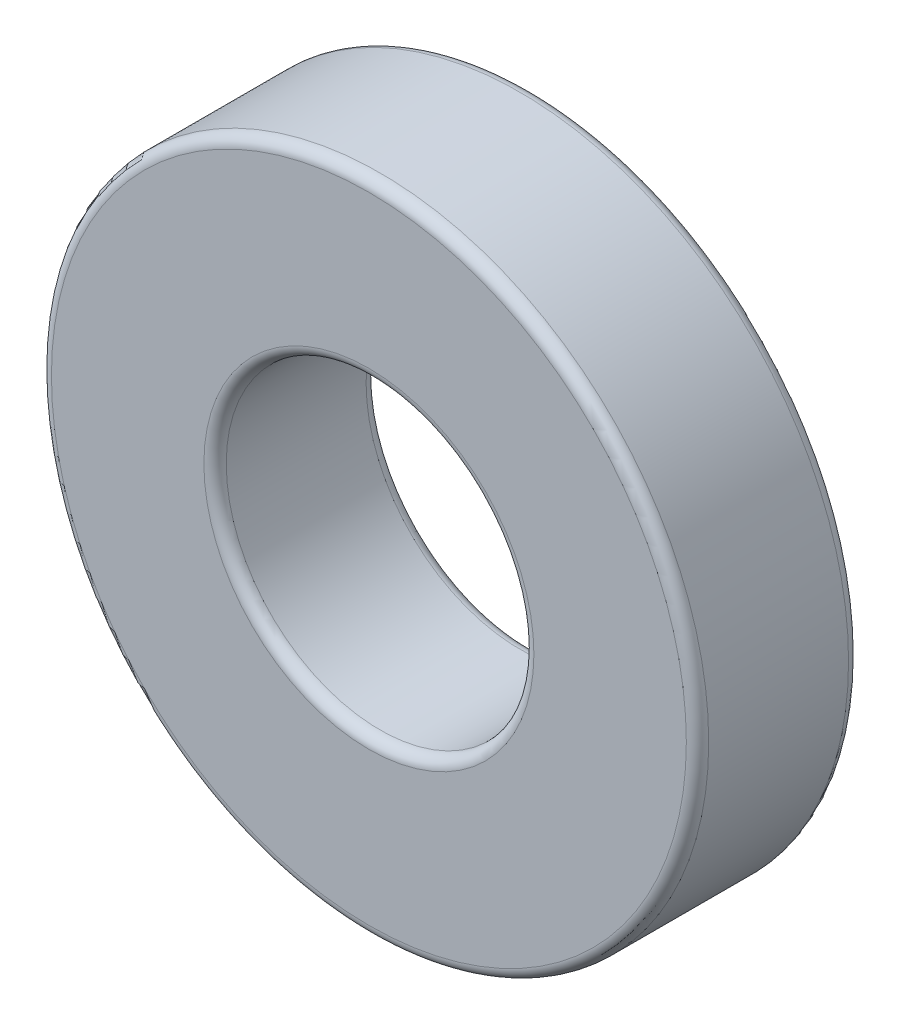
SolidWorks part; units mm, degrees
ref_plane "Face" through (0, 0, 0) normal (0, 0, 1) x (1, 0, 0)
ref_plane "Dessus" through (0, 0, 0) normal (0, 1, 0) x (1, 0, 0)
ref_plane "Droite" through (0, 0, 0) normal (1, 0, 0) x (0, 0, -1)
sketch "E_corps" plane through (0, 0, 0) normal (1, 0, 0) x (0, 0, -1)
  line L0 (-33.1757, 0) -> (55.1783, 0) construction
  line L1 (2, 58.75) -> (27, 58.75)
  line L2 (29, 56.75) -> (29, 29.5)
  line L3 (27, 27.5) -> (2, 27.5)
  line L4 (0, 29.5) -> (0, 56.75)
  line L5 (0, 50) -> (0, -50) construction
  arc A0 (0, 56.75) -> (2, 58.75) centre (2, 56.75) cw
  arc A1 (29, 56.75) -> (27, 58.75) centre (27, 56.75) ccw
  arc A2 (2, 27.5) -> (0, 29.5) centre (2, 29.5) cw
  arc A3 (29, 29.5) -> (27, 27.5) centre (27, 29.5) cw
  dimension "Rayon" = 2
  dimension "Rayon3" = 2
  dimension "Rayon1" = 2
  dimension "Rayon2" = 2
  dimension "Largeur" = 29
  dimension "Diamètre_nominal" = 55
  dimension "Diamètre_extérieur" = 117.5
revolve "corps" add sketch "E_corps" angle 360 about L0
sketch "E_symbole" plane through (0, 0, 0) normal (1, 0, 0) x (0, 0, -1)
  line L0 (-3.4482, 43.125) -> (19.8356, 43.125) construction
  line L1 (-33.1757, 0) -> (55.1783, 0) construction
  line L2 (2.9, 43.12) -> (2.9, 43.13)
  line L3 (2.9, 43.13) -> (14.495, 43.13)
  line L4 (2.9, 43.12) -> (14.495, 43.12)
  line L5 (14.495, 43.13) -> (14.495, 50.9375)
  line L6 (14.495, 43.12) -> (14.495, 35.3125)
  line L7 (14.495, 50.9375) -> (14.505, 50.9375)
  line L8 (14.495, 35.3125) -> (14.505, 35.3125)
  line L9 (14.5, 16.6578) -> (14.5, 5.8829) construction
  line L10 (14.505, 43.13) -> (14.505, 50.9375)
  line L11 (26.1, 43.13) -> (14.505, 43.13)
  line L12 (26.1, 43.12) -> (26.1, 43.13)
  line L13 (26.1, 43.12) -> (14.505, 43.12)
  line L14 (14.505, 43.12) -> (14.505, 35.3125)
  line L15 (29, 56.75) -> (29, 29.5) construction
  line L17 (2, 58.75) -> (27, 58.75) construction
  line L18 (0, 29.5) -> (0, 56.75) construction
  line L19 (-8.3118, 0) -> (25.8663, 0) construction
  point P7 (2.9, 43.125)
  point P16 (14.5, 35.3125)
  point P17 (14.5, 50.9375)
  dimension "D1" = 43.125
  dimension "D2" = 2.9
  dimension "D3" = 0.01
  dimension "D4" = 0.01
  dimension "D5" = 7.8125
  dimension "D6" = 14.5
other "Symbole" parameters "D1"=360, "D3"=0.01, "D4"=1, "D7"=0
equation "\"Rayon3@E_corps\" = \"Rayon@E_corps\""
equation "\"Rayon2@E_corps\" = \"Rayon@E_corps\""
equation "\"Rayon1@E_corps\" = \"Rayon@E_corps\""
equation "\"D1@E_symbole\" = (\"Diamètre_nominal@E_corps\"+\"Diamètre_extérieur@E_corps\")/4"
equation "\"D2@E_symbole\" = 0.1*\"Largeur@E_corps\""
equation "\"D4@E_symbole\" = \"D3@E_symbole\""
equation "\"D5@E_symbole\" =   ( ( \"Diamètre_extérieur@E_corps\" - \"Diamètre_nominal@E_corps\")/2 )  * 0.25"
equation "\"D6@E_symbole\" = 0.5*\"Largeur@E_corps\""
